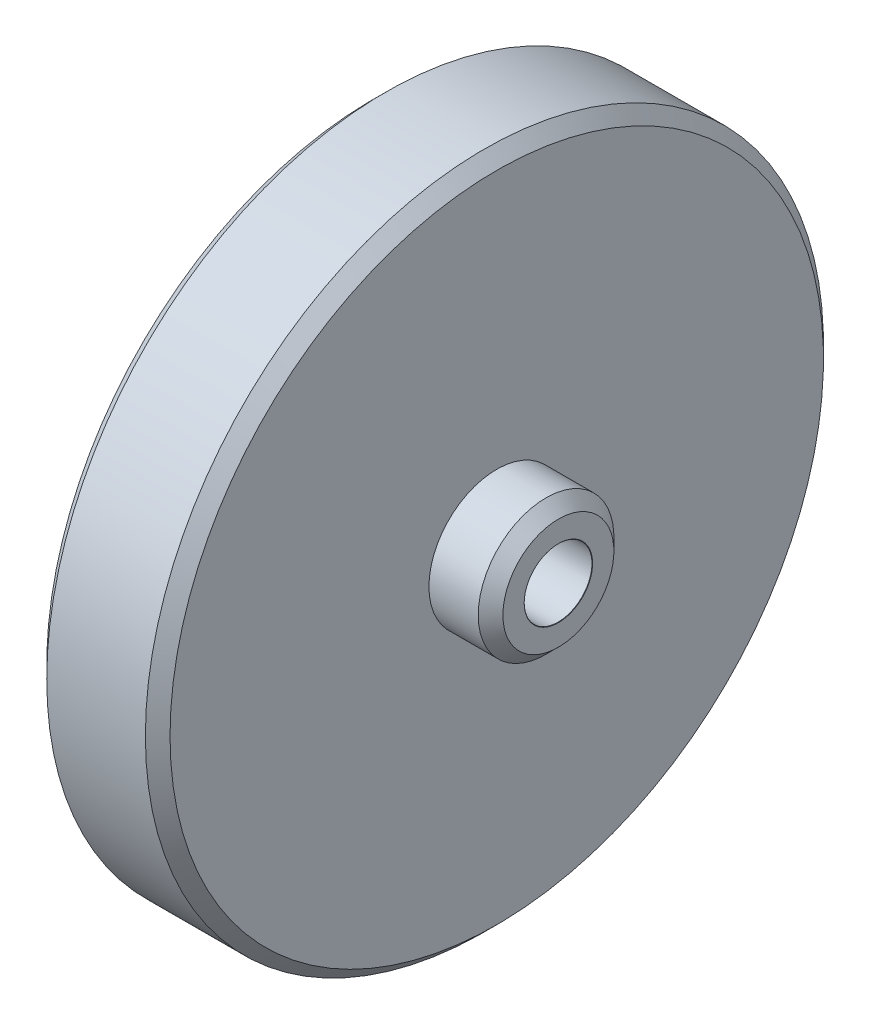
SolidWorks part; units mm, degrees
ref_plane "Face" through (0, 0, 0) normal (0, 0, 1) x (1, 0, 0)
ref_plane "Dessus" through (0, 0, 0) normal (0, 1, 0) x (1, 0, 0)
ref_plane "Droite" through (0, 0, 0) normal (1, 0, 0) x (0, 0, -1)
sketch "Esquisse1" plane through (0, 0, 0) normal (0, 0, 1) x (1, 0, 0)
  line L0 (0, 5.5) -> (0, 27.5)
  line L1 (0, 27.5) -> (-10, 27.5)
  line L2 (-10, 27.5) -> (-10, 0)
  line L3 (-10, 0) -> (0, 0)
  line L4 (0, 5.5) -> (4, 5.5)
  line L5 (5, 0) -> (0, 0)
  line L6 (5, 0) -> (5, 4.5)
  line L7 (4, 5.5) -> (5, 4.5)
  point P6 (5, 5.5)
  dimension "D1" = 27.5
  dimension "D2" = 10
  dimension "D3" = 5
  dimension "D4" = 5.5
  dimension "D7" = 1
revolve "Révolution1" add sketch "Esquisse1" angle 360 about L3
chamfer "Chanfrein1" distance 1 angle 45 2 edges at (-10, 0, 27.5) (0, 0, 27.5)
hole_wizard "Chambrage pour vis à tête hexagonale M51" positions "Esquisse3" profile "Esquisse2" counterbore size "M5" standard "ISO"
sketch "Esquisse3" plane through (-10, 0, 0) normal (-1, 0, 0) x (0, 0, 1)
  point P0 (0, 0)
sketch "Esquisse2" plane through (-10, 0, 0) normal (0, 1, 0) x (0, 0, 1)
  line L0 (0, 0) -> (0, 15)
  line L1 (2.75, 14.975) -> (2.775, 15)
  line L2 (5, 5) -> (2.75, 5)
  line L3 (2.75, 5) -> (2.75, 14.975)
  line L5 (5, 5) -> (5, 0.025)
  line L6 (5, 0.025) -> (5.025, 0)
  line L7 (5.025, 0) -> (0, 0)
  line L8 (-5, 0.025) -> (-5.025, 0) construction
  line L11 (0, -6.35) -> (0, 107.95) construction
  line L12 (2.775, 15) -> (0, 15)
  line L13 (-2.75, 14.975) -> (-2.775, 15) construction
  dimension "Diamètre du perçage jusqu'au prochain" = 5.5
  dimension "Profondeur du perçage jusqu'au prochain" = 15
  dimension "Diamètre du chambrage" = 10
  dimension "Profondeur du chambrage" = 5
  dimension "Diamètre du fraisage entrant" = 10.05
  dimension "Angle du fraisage entrant" = 90
  dimension "Diamètre du fraisage débouchant" = 5.55
  dimension "Angle du fraisage débouchant" = 90
